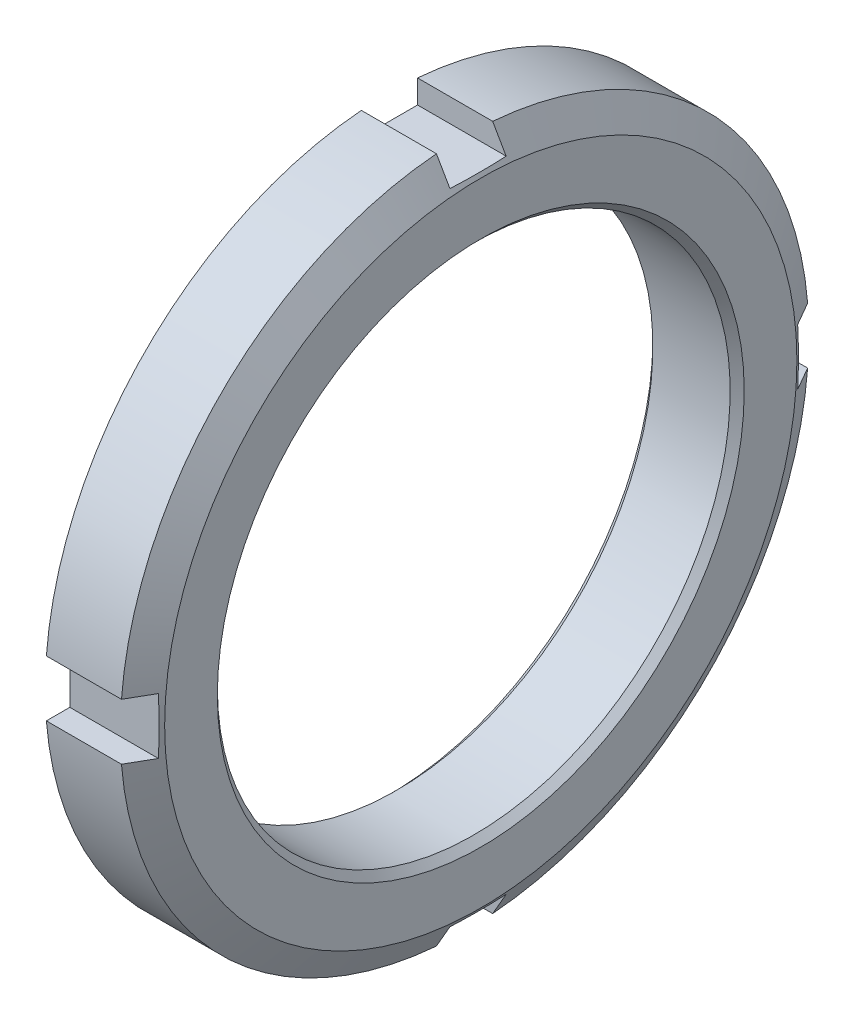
SolidWorks part; units mm, degrees
ref_plane "Plan de face" through (0, 0, 0) normal (0, 0, 1) x (1, 0, 0)
ref_plane "Plan de dessus" through (0, 0, 0) normal (0, 1, 0) x (1, 0, 0)
ref_plane "Plan de droite" through (0, 0, 0) normal (1, 0, 0) x (0, 0, -1)
sketch "Esquisse1" plane through (0, 0, 0) normal (0, 0, 1) x (1, 0, 0)
  line L0 (0, 0) -> (0, 49)
  line L1 (0, 49) -> (10.6906, 49)
  line L2 (10.6906, 49) -> (13, 45)
  line L3 (13, 45) -> (13, 0)
  line L4 (13, 0) -> (0, 0)
  line L5 (13, 0) -> (0, 0) construction
  dimension "D1" = 13
  dimension "D2" = 30
  dimension "D3" = 4
  dimension "D4" = 49
revolve "Révolution1" add sketch "Esquisse1" angle 360 about L5
sketch "Esquisse2" plane through (0, 0, 0) normal (0, 0, 1) x (1, 0, 0)
  line L0 (0, 0) -> (0, 37.5)
  line L1 (0, 37.5) -> (1, 36.5)
  line L2 (1, 36.5) -> (12, 36.5)
  line L3 (12, 36.5) -> (13, 37.5)
  line L4 (13, 37.5) -> (13, 0)
  line L5 (13, 0) -> (0, 0)
  line L6 (13, 0) -> (0, 0) construction
  line L7 (0, 49) -> (0, -49) construction
  line L8 (13, -45) -> (13, 45) construction
  dimension "D1" = 37.5
  dimension "D2" = 45
  dimension "D3" = 45
  dimension "D4" = 1
revolve "Enlèvement de matière-Révolution1" cut sketch "Esquisse2" angle 360 about L6
sketch "Esquisse3" plane through (0, 0, 0) normal (1, 0, 0) x (0, 0, -1)
  line L0 (-75, 75) -> (-75, -75)
  line L1 (-75, -75) -> (75, -75)
  line L2 (75, -75) -> (75, 75)
  line L3 (75, 75) -> (-75, 75)
  line L4 (-49, 4) -> (-45.5, 4)
  line L5 (-45.5, 4) -> (-45.5, -4)
  line L6 (-45.5, -4) -> (-49, -4)
  line L7 (-49, -4) -> (-49, -49)
  line L8 (-49, -49) -> (-4, -49)
  line L9 (-4, -49) -> (-4, -45.5)
  line L10 (-4, -45.5) -> (4, -45.5)
  line L11 (4, -45.5) -> (4, -49)
  line L12 (4, -49) -> (49, -49)
  line L13 (49, -49) -> (49, -4)
  line L14 (49, -4) -> (45.5, -4)
  line L15 (45.5, -4) -> (45.5, 4)
  line L16 (45.5, 4) -> (49, 4)
  line L17 (49, 4) -> (49, 49)
  line L18 (49, 49) -> (4, 49)
  line L19 (4, 49) -> (4, 45.5)
  line L20 (4, 45.5) -> (-4, 45.5)
  line L21 (-4, 45.5) -> (-4, 49)
  line L22 (-4, 49) -> (-49, 49)
  line L23 (-49, 49) -> (-49, 4)
  line L24 (-49, 49) -> (49, -49) construction
  line L25 (-75, 75) -> (75, -75) construction
  circle A0 centre (0, 0) radius 49 construction
  dimension "D1" = 91
  dimension "D2" = 91
  dimension "D3" = 8
  dimension "D4" = 8
  dimension "D5" = 150
extrude "Enlèv. mat.-Extru.1" cut sketch "Esquisse3" along normal blind 13
